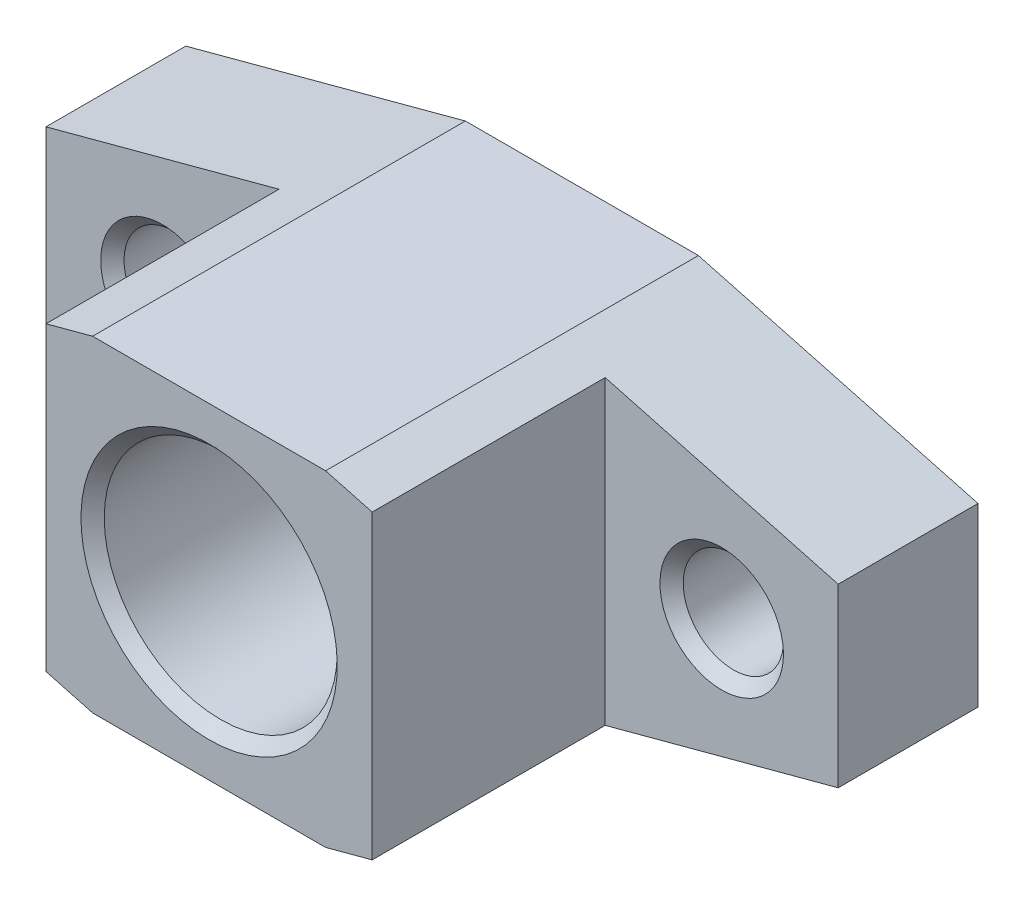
SolidWorks part; units mm, degrees
ref_plane "正面" through (0, 0, 0) normal (0, 0, 1) x (1, 0, 0)
ref_plane "平面" through (0, 0, 0) normal (0, 1, 0) x (1, 0, 0)
ref_plane "右側面" through (0, 0, 0) normal (1, 0, 0) x (0, 0, -1)
sketch "ｽｹｯﾁ1" plane through (0, 0, 0) normal (0, 1, 0) x (1, 0, 0)
  line L0 (0, 59.0661) -> (0, -52.2037) construction
  line L1 (-5, 7) -> (5, 7)
  line L2 (-5, -7) -> (5, -7)
  line L3 (-5, 7) -> (-17, 3.7846)
  line L4 (-17, 3.7846) -> (-17, -3.7846)
  line L5 (-17, -3.7846) -> (-5, -7)
  line L6 (0, 0) -> (-17, 0) construction
  line L7 (17, -3.7846) -> (5, -7)
  line L8 (17, 3.7846) -> (17, -3.7846)
  line L9 (5, 7) -> (17, 3.7846)
  circle A2 centre (0, 0) radius 7 construction
  circle A3 centre (12, 0) radius 3.5 construction
  point P4 (0, 7)
  point P11 (0, -7)
  dimension "D1" = 14
  dimension "D2" = 7
  dimension "D4" = 14
  dimension "D3" = 10
  dimension "D5" = 7
  dimension "D6" = 24
  dimension "D7" = 1.5
  dimension "D8" = 34
  dimension "D9" = 15
extrude "押し出し1" add sketch "ｽｹｯﾁ1" along normal blind 6
sketch "ｽｹｯﾁ2" plane through (0, 0, 0) normal (0, 1, 0) x (-1, 0, 0)
  line L1 (-5, 7) -> (5, 7)
  line L2 (-7, 6.4641) -> (-7, -6.4641)
  line L3 (-5, -7) -> (5, -7)
  line L4 (7, 6.4641) -> (7, -6.4641)
  line L5 (0, -31.1666) -> (0, 17.6577) construction
  line L8 (5, 7) -> (-5, 7) construction
  line L9 (-5, 7) -> (-17, 3.7846) construction
  line L10 (17, 3.7846) -> (5, 7) construction
  line L11 (-17, -3.7846) -> (-5, -7) construction
  line L12 (5, -7) -> (17, -3.7846) construction
  line L13 (-5, 7) -> (-7, 6.4641)
  line L14 (7, 6.4641) -> (5, 7)
  line L15 (-7, -6.4641) -> (-5, -7)
  line L16 (5, -7) -> (7, -6.4641)
  dimension "D1" = 14
extrude "押し出し2" add sketch "ｽｹｯﾁ2" along normal blind 16
hole_wizard "穴1" positions "ｽｹｯﾁ4" profile "ｽｹｯﾁ3" legacy
sketch "ｽｹｯﾁ4" plane through (0, 6, 0) normal (0, 1, 0) x (-1, 0, 0)
  circle A0 centre (12, 0) radius 4.5 construction
  point P0 (12, 0)
  point P1 (-12, 0)
  dimension "D3" = 9
  dimension "D1" = 12
  dimension "D2" = 12
sketch "ｽｹｯﾁ3" plane through (-12, 6, 0) normal (1, 0, 0) x (0, 0, 1)
  line L0 (0, 0) -> (0, 100)
  line L1 (0, 100) -> (2.15, 100)
  line L2 (2.15, 100) -> (2.15, 0)
  line L3 (2.15, 0) -> (0, 0)
  line L4 (0, 110) -> (0, -10) construction
  dimension "直径" = 4.3
  dimension "深さ" = 100
sketch "ｽｹｯﾁ5" plane through (0, 16, 0) normal (0, 1, 0) x (-1, 0, 0)
  circle A0 centre (0, 0) radius 5
  dimension "D1" = 10
extrude "ｶｯﾄ - 押し出し1" cut sketch "ｽｹｯﾁ5" against normal through all
chamfer "面取り1" distance 0.5 angle 45 1 edges at (0, 16, 5)
chamfer "面取り3" distance 0.5 angle 45 5 edges at (-12, 6, 2.15) (12, 6, 2.15) (-12, 0, 2.15) (12, 0, 2.15) (0, 0, 5)
move or copy body "ﾎﾞﾃﾞｨ-移動/ｺﾋﾟｰ1" bodies to move or copy 104 copy no rotation origin (0, 0, 0) rotation axis (1, 0, 0) rotation angle 90
move or copy body "ﾎﾞﾃﾞｨ-移動/ｺﾋﾟｰ2" bodies to move or copy 140 copy no translate (12, 0, 0)
